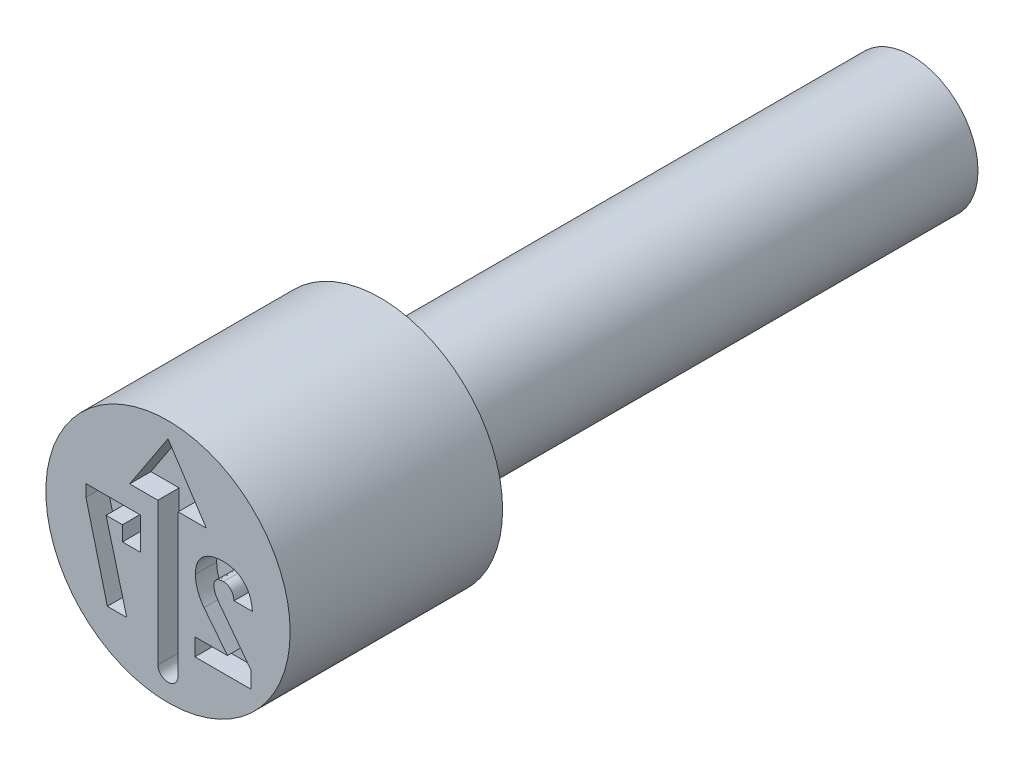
SolidWorks part; units mm, degrees
ref_plane "Front Plane" through (0, 0, 0) normal (0, 0, 1) x (1, 0, 0)
ref_plane "Top Plane" through (0, 0, 0) normal (0, 1, 0) x (1, 0, 0)
ref_plane "Right Plane" through (0, 0, 0) normal (1, 0, 0) x (0, 0, -1)
sketch "Sketch2" plane through (0, 0, 0) normal (1, 0, 0) x (0, 0, -1)
  line L0 (0.4039, 0) -> (50000.4039, 0) construction
  line L6 (0, 2.3) -> (0, 0)
  line L7 (4, 2.3) -> (0, 2.3)
  line L8 (4, 1.25) -> (4, 2.3)
  line L9 (14, 1.25) -> (4, 1.25)
  line L10 (14, 0) -> (14, 1.25)
  line L11 (0, 0) -> (14, 0)
  dimension "D1" = 4.6
  dimension "D2" = 2.5
  dimension "D3" = 14
  dimension "D4" = 4
revolve "Revolve1" add sketch "Sketch2" angle 360 about L0
sketch "Sketch3" plane through (0, 0, 0) normal (0, 0, 1) x (1, 0, 0)
  line L0 (0, 0) -> (0, 100000) construction
  line L1 (0.1905, 0.9064) -> (0.1905, -1.7762)
  line L2 (0.7219, 0.9064) -> (0.1905, 0.9064)
  line L3 (0, 2.0021) -> (0.7219, 0.9064)
  line L15 (0, 2.0021) -> (-0.7219, 0.9064)
  line L16 (-0.7219, 0.9064) -> (-0.1905, 0.9064)
  line L17 (-0.1905, 0.9064) -> (-0.1905, -1.7762)
  arc A2 (-0.1905, -1.7762) -> (0.1905, -1.7762) centre (0, -1.7762) ccw
extrude "Cut-Extrude4" cut sketch "Sketch3" against normal blind 0.4
sketch "Sketch4" plane through (0, 0, 0) normal (0, 0, 1) x (1, 0, 0)
  text T0 "2  7" font "Bahnschrift" height 1.8
  dimension "D1" = 1.3
  dimension "D2" = 1.7
extrude "Cut-Extrude5" cut sketch "Sketch4" against normal blind 0.4
